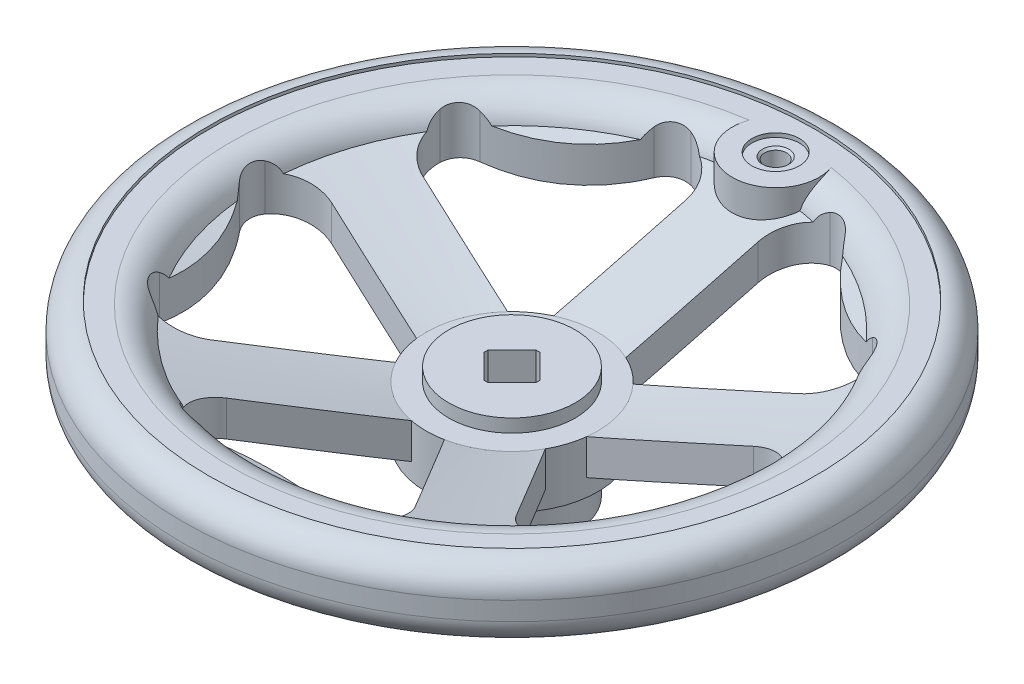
SolidWorks part; units mm, degrees
ref_plane "Front X-Y" through (0, 0, 0) normal (0, 0, 1) x (1, 0, 0)
ref_plane "Top X-Z" through (0, 0, 0) normal (0, 1, 0) x (1, 0, 0)
ref_plane "Right Y-Z" through (0, 0, 0) normal (1, 0, 0) x (0, 0, -1)
ref_plane "Plane1" through (0, 0, 0) normal (0, 0, 1) x (1, 0, 0)
sketch "Sketch1" plane through (0, 0, 0) normal (0, 0, 1) x (1, 0, 0)
  line L0 (0, 44) -> (24, 44)
  line L1 (24, 44) -> (24, 36.7224)
  line L2 (24, 36.7224) -> (95.153, 55.7878)
  line L3 (106.65, 64.35) -> (115, 64.35)
  line L4 (115, 64.35) -> (115, 65.5)
  line L5 (125, 55.5) -> (125, 48.5)
  line L6 (115, 38.5) -> (115, 40.35)
  line L7 (115, 40.35) -> (105.77, 40.35)
  line L8 (103.3017, 41.0017) -> (99.1, 43.3868)
  line L9 (99.1, 43.3868) -> (24, 23.2638)
  line L10 (24, 23.2638) -> (24, 1.5)
  line L11 (24, 1.5) -> (22.5, 0)
  line L12 (22.5, 0) -> (0, 0)
  line L13 (0, 0) -> (0, 44)
  line L14 (0, 0) -> (0, 44) construction
  arc A0 (95.153, 55.7878) -> (106.65, 64.35) centre (106.65, 52.35) cw
  arc A1 (115, 65.5) -> (125, 55.5) centre (115, 55.5) cw
  arc A2 (125, 48.5) -> (115, 38.5) centre (115, 48.5) cw
  arc A3 (105.77, 40.35) -> (103.3017, 41.0017) centre (105.77, 45.35) cw
revolve "Revolve1" add sketch "Sketch1" angle 360 about L14
ref_plane "Plane2" through (0, 0, 0) normal (0, 1, 0) x (1, 0, 0)
sketch "Sketch2" plane through (0, 0, 0) normal (0, 1, 0) x (1, 0, 0)
  line L0 (35.7533, -72.5181) -> (5.9146, -31.4486)
  line L1 (-5.9146, -31.4486) -> (-35.7533, -72.5181)
  arc A0 (-35.7533, -72.5181) -> (-34.104, -91.7792) centre (-23.5, -81.17) ccw
  arc A1 (-34.104, -91.7792) -> (-23.6553, -94.1181) centre (-27.0347, -84.7064) ccw
  arc A2 (-23.6553, -94.1181) -> (23.6553, -94.1181) centre (0, -160) cw
  arc A3 (23.6553, -94.1181) -> (34.104, -91.7792) centre (27.0347, -84.7064) ccw
  arc A4 (34.104, -91.7792) -> (35.7533, -72.5181) centre (23.5, -81.17) ccw
  arc A5 (5.9146, -31.4486) -> (-5.9146, -31.4486) centre (0, 0) cw
extrude "Cut-Extrude1" cut sketch "Sketch2" along normal blind 65.5
ref_plane "Plane3" through (0, 0, 0) normal (0, 1, 0) x (1, 0, 0)
sketch "Sketch3" plane through (0, 0, 0) normal (0, 1, 0) x (1, 0, 0)
  line L0 (13.7, 79.6836) -> (13.7, 28.919)
  line L1 (23.2701, 21.9659) -> (71.5501, 37.6531)
  arc A0 (71.5501, 37.6531) -> (81.5372, 54.2051) centre (66.7224, 51.855) ccw
  arc A1 (81.5372, 54.2051) -> (74.4588, 62.2389) centre (71.6607, 52.6383) ccw
  arc A2 (74.4588, 62.2389) -> (36.1837, 90.0474) centre (94.0456, 129.4427) cw
  arc A3 (36.1837, 90.0474) -> (26.3557, 94.2968) centre (27.9177, 84.4195) ccw
  arc A4 (26.3557, 94.2968) -> (13.7, 79.6836) centre (28.6986, 79.4809) ccw
  arc A5 (13.7, 28.919) -> (23.2701, 21.9659) centre (0, 0) cw
extrude "Cut-Extrude2" cut sketch "Sketch3" along normal blind 65.5
ref_plane "Plane4" through (0, 0, 0) normal (0, 1, 0) x (1, 0, 0)
sketch "Sketch4" plane through (0, 0, 0) normal (0, 1, 0) x (1, 0, 0)
  line L0 (-57.9204, -56.4127) -> (-28.0817, -15.3433)
  line L1 (-31.7372, -4.093) -> (-80.0172, 11.5941)
  arc A0 (-80.0172, 11.5941) -> (-97.8259, 4.0735) centre (-84.4592, -2.7331) ccw
  arc A1 (-97.8259, 4.0735) -> (-96.8215, -6.5865) centre (-88.9147, -0.4642) ccw
  arc A2 (-96.8215, -6.5865) -> (-82.2017, -51.5817) centre (-152.169, -49.4427) cw
  arc A3 (-82.2017, -51.5817) -> (-76.7485, -60.7962) centre (-72.2064, -51.8872) ccw
  arc A4 (-76.7485, -60.7962) -> (-57.9204, -56.4127) centre (-69.9354, -47.4327) ccw
  arc A5 (-28.0817, -15.3433) -> (-31.7372, -4.093) centre (0, 0) cw
extrude "Cut-Extrude3" cut sketch "Sketch4" along normal blind 65.5
ref_plane "Plane5" through (0, 0, 0) normal (0, 1, 0) x (1, 0, 0)
sketch "Sketch5" plane through (0, 0, 0) normal (0, 1, 0) x (1, 0, 0)
  line L0 (80.0172, 11.5941) -> (31.7372, -4.093)
  line L1 (28.0817, -15.3433) -> (57.9204, -56.4127)
  arc A0 (57.9204, -56.4127) -> (76.7485, -60.7962) centre (69.9354, -47.4327) ccw
  arc A1 (76.7485, -60.7962) -> (82.2017, -51.5817) centre (72.2064, -51.8872) ccw
  arc A2 (82.2017, -51.5817) -> (96.8215, -6.5865) centre (152.169, -49.4427) cw
  arc A3 (96.8215, -6.5865) -> (97.8259, 4.0735) centre (88.9147, -0.4642) ccw
  arc A4 (97.8259, 4.0735) -> (80.0172, 11.5941) centre (84.4592, -2.7331) ccw
  arc A5 (31.7372, -4.093) -> (28.0817, -15.3433) centre (0, 0) cw
extrude "Cut-Extrude4" cut sketch "Sketch5" along normal blind 65.5
ref_plane "Plane6" through (0, 0, 0) normal (0, 1, 0) x (1, 0, 0)
sketch "Sketch6" plane through (0, 0, 0) normal (0, 1, 0) x (1, 0, 0)
  line L0 (-71.5501, 37.6531) -> (-23.2701, 21.9659)
  line L1 (-13.7, 28.919) -> (-13.7, 79.6836)
  arc A0 (-13.7, 79.6836) -> (-26.3557, 94.2968) centre (-28.6986, 79.4809) ccw
  arc A1 (-26.3557, 94.2968) -> (-36.1837, 90.0474) centre (-27.9177, 84.4195) ccw
  arc A2 (-36.1837, 90.0474) -> (-74.4588, 62.2389) centre (-94.0456, 129.4427) cw
  arc A3 (-74.4588, 62.2389) -> (-81.5372, 54.2051) centre (-71.6607, 52.6383) ccw
  arc A4 (-81.5372, 54.2051) -> (-71.5501, 37.6531) centre (-66.7224, 51.855) ccw
  arc A5 (-23.2701, 21.9659) -> (-13.7, 28.919) centre (0, 0) cw
extrude "Cut-Extrude5" cut sketch "Sketch6" along normal blind 65.5
ref_plane "Plane7" through (0, 0, 0) normal (0, 0, 1) x (1, 0, 0)
sketch "Sketch7" plane through (0, 0, 0) normal (0, 0, 1) x (1, 0, 0)
  line L0 (0, 39) -> (32.5, 39)
  line L1 (32.5, 39) -> (32.5, 19)
  line L2 (32.5, 19) -> (0, 19)
  line L3 (0, 19) -> (0, 39)
  line L4 (0, 0) -> (0, 44) construction
revolve "Revolve2" add sketch "Sketch7" angle 360 about L4
ref_plane "Plane8" through (0, 0, 0) normal (1, 0, 0) x (0, 0, -1)
sketch "Sketch8" plane through (0, 0, 0) normal (1, 0, 0) x (0, 0, -1)
  line L0 (100, 64.35) -> (116.5, 64.35)
  line L1 (116.5, 64.35) -> (116.5, 40.35)
  line L2 (116.5, 40.35) -> (100, 40.35)
  line L3 (100, 40.35) -> (100, 64.35)
  line L4 (100, -50) -> (100, 50) construction
revolve "Revolve3" add sketch "Sketch8" angle 360 about L4
ref_plane "Plane9" through (0, 0, 0) normal (1, 0, 0) x (0, 0, -1)
sketch "Sketch9" plane through (0, 0, 0) normal (1, 0, 0) x (0, 0, -1)
  line L0 (100, 64.35) -> (109, 64.35)
  line L1 (109, 64.35) -> (109, 62.85)
  line L2 (109, 62.85) -> (100, 62.85)
  line L3 (100, 62.85) -> (100, 64.35)
  line L4 (100, -50) -> (100, 50) construction
revolve "Cut-Revolve1" cut sketch "Sketch9" angle 360 about L4
ref_plane "Plane10" through (0, 0, 0) normal (0, 1, 0) x (1, 0, 0)
sketch "Sketch10" plane through (0, 0, 0) normal (0, 1, 0) x (1, 0, 0)
  line L0 (-9.8995, 0.7071) -> (-9.8995, -0.7071)
  line L1 (-9.8995, -0.7071) -> (-0.7071, -9.8995)
  line L2 (-0.7071, -9.8995) -> (0.7071, -9.8995)
  line L3 (0.7071, -9.8995) -> (9.8995, -0.7071)
  line L4 (9.8995, -0.7071) -> (9.8995, 0.7071)
  line L5 (9.8995, 0.7071) -> (0.7071, 9.8995)
  line L6 (0.7071, 9.8995) -> (-0.7071, 9.8995)
  line L7 (-0.7071, 9.8995) -> (-9.8995, 0.7071)
extrude "Cut-Extrude6" cut sketch "Sketch10" along normal blind 44
ref_plane "Plane11" through (0, 0, 0) normal (1, 0, 0) x (0, 0, -1)
sketch "Sketch11" plane through (0, 0, 0) normal (1, 0, 0) x (0, 0, -1)
  line L0 (100, 62.85) -> (105, 62.85)
  line L1 (105, 62.85) -> (104.188, 62.038)
  line L2 (104.188, 62.038) -> (104.188, 40.35)
  line L3 (104.188, 40.35) -> (100, 40.35)
  line L4 (100, 40.35) -> (100, 62.85)
  line L5 (100, 40.35) -> (100, 62.85) construction
revolve "Cut-Revolve2" cut sketch "Sketch11" angle 360 about L5
